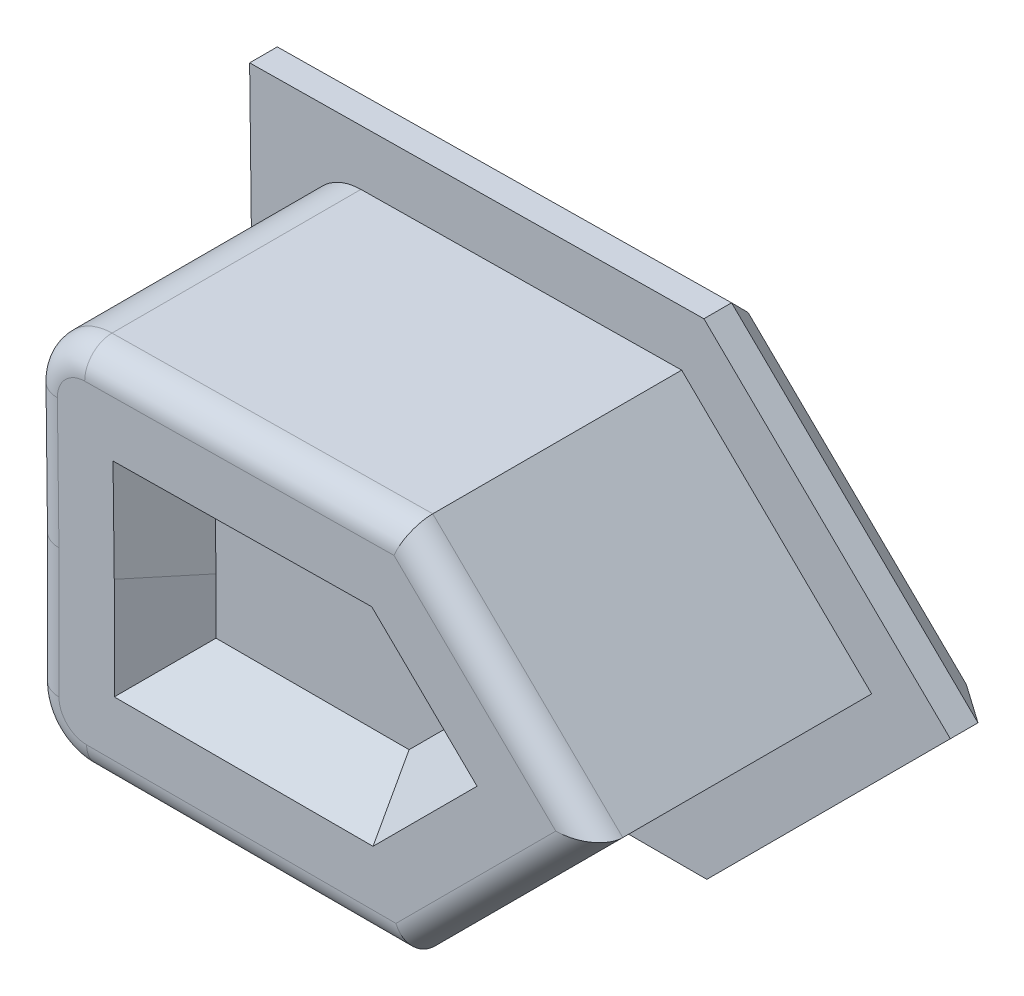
SolidWorks part; units mm, degrees
ref_plane "Plan de face" through (0, 0, 0) normal (0, 0, 1) x (1, 0, 0)
ref_plane "Plan de dessus" through (0, 0, 0) normal (0, 1, 0) x (1, 0, 0)
ref_plane "Plan de droite" through (0, 0, 0) normal (1, 0, 0) x (0, 0, -1)
sketch "Esquisse1" plane through (0, 0, 0) normal (0, 0, 1) x (1, 0, 0)
  line L0 (-5.0971, -3.3632) -> (1.7029, -3.3632)
  line L1 (1.7029, -3.3632) -> (5.0971, 0.0309)
  line L2 (-5.0971, -3.3632) -> (-5.0971, -0.0309)
  line L3 (-5.0971, -0.0309) -> (5.0971, 0.0309) construction
  line L4 (1.662, 3.3836) -> (5.0971, 0.0309)
  line L5 (-5.1375, 3.3012) -> (1.662, 3.3836)
  line L6 (-5.1375, 3.3012) -> (-5.0971, -0.0309)
  dimension "D1" = 4.8
  dimension "D2" = 6.8
  dimension "D3" = 135
extrude "Boss.-Extru.1" add sketch "Esquisse1" along normal blind 5
sketch "Esquisse2" plane through (0, 0, 0) normal (0, 0, -1) x (-1, 0, 0)
  line L8 (-1.6984, 0.3838) -> (5.1011, 0.3014)
  line L9 (-1.6984, 0.3838) -> (5.1011, 0.3014)
  line L21 (6.0971, -4.3632) -> (6.0971, -0.037)
  line L22 (6.0971, -0.037) -> (6.1495, 4.289)
  line L23 (6.1495, 4.289) -> (-2.0641, 4.3886)
  line L24 (-2.0641, 4.3886) -> (-6.5199, 0.0395)
  line L25 (-6.5199, 0.0395) -> (-2.1172, -4.3632)
  line L26 (-2.1172, -4.3632) -> (6.0971, -4.3632)
  line L27 (6.0971, -4.3632) -> (6.0971, -0.037)
  line L28 (6.0971, -0.037) -> (6.1495, 4.289)
  line L29 (6.1495, 4.289) -> (-2.0641, 4.3886)
  line L30 (-2.0641, 4.3886) -> (-6.5199, 0.0395)
  line L31 (-6.5199, 0.0395) -> (-2.1172, -4.3632)
  line L32 (-2.1172, -4.3632) -> (6.0971, -4.3632)
  dimension "D1" = 3
  dimension "D2" = 1
extrude "Boss.-Extru.2" add sketch "Esquisse2" along normal blind 1
chamfer "Chanfrein1" distance 0.5 angle 45 6 edges at (4.292, 2.214, -1) (-2.0427, 4.3388, -1) (-6.1233, 2.126, -1) (-6.0971, -2.2001, -1) (-1.9899, -4.3632, -1) (4.3185, -2.1618, -1)
sketch "Esquisse3" plane through (0, 0, 5) normal (0, 0, 1) x (1, 0, 0)
  line L12 (-3.5971, -0.0218) -> (-3.5971, -1.8632)
  line L13 (-3.5971, -1.8632) -> (1.0816, -1.8632)
  line L14 (1.0816, -1.8632) -> (2.9628, 0.018)
  line L15 (2.9628, 0.018) -> (1.059, 1.8762)
  line L16 (1.059, 1.8762) -> (-3.6194, 1.8195)
  line L17 (-3.6194, 1.8195) -> (-3.5971, -0.0218)
  line L18 (-3.5971, -0.0218) -> (-3.5971, -1.8632)
  line L19 (-3.5971, -1.8632) -> (1.0816, -1.8632)
  line L20 (1.0816, -1.8632) -> (2.9628, 0.018)
  line L21 (2.9628, 0.018) -> (1.059, 1.8762)
  line L22 (1.059, 1.8762) -> (-3.6194, 1.8195)
  line L23 (-3.6194, 1.8195) -> (-3.5971, -0.0218)
  dimension "D1" = 1.5
extrude "Enlèv. mat.-Extru.1" cut sketch "Esquisse3" against normal blind 1 draft 40 contours L18 L19 L20 L21 L22 L23
fillet "Congé1" radius 1 2 edges at (-5.0971, -3.3632, 2.5) (-5.1375, 3.3012, 2.5)
fillet "Congé2" radius 0.5 8 edges at (3.4, -1.6662, 5) (3.3795, 1.7073, 5) (-1.2377, 3.3484, 5) (-4.841, 3.0118, 5) (-5.1112, 1.1352, 5) (-5.0971, -1.1971, 5) (-4.8042, -3.0703, 5) (-1.1971, -3.3632, 5)
